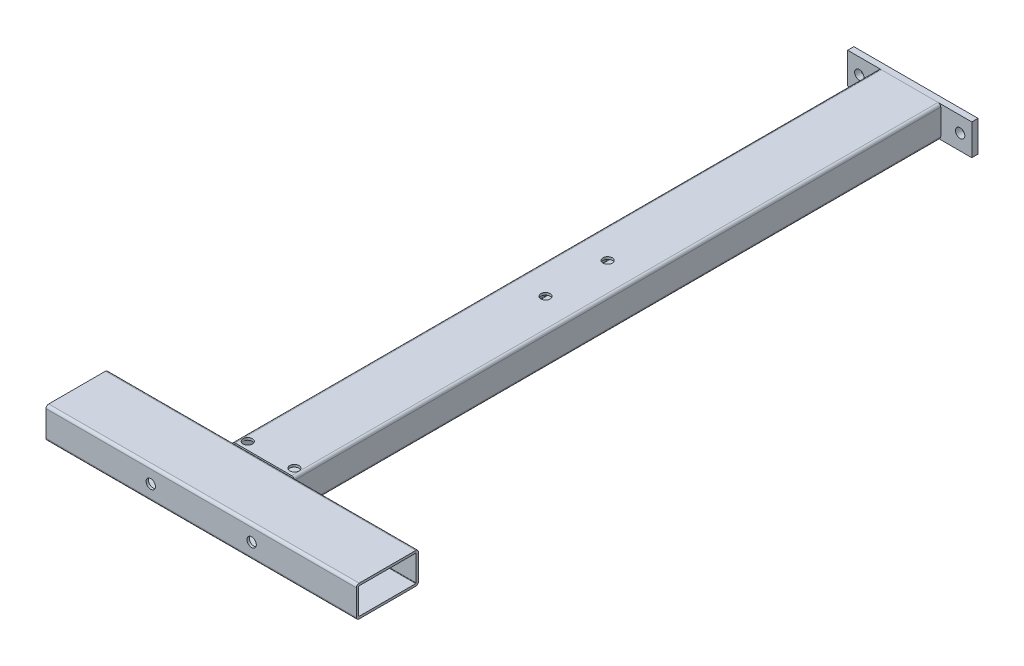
SolidWorks part; units mm, degrees
ref_plane "Plan de face" through (0, 0, 0) normal (0, 0, 1) x (1, 0, 0)
ref_plane "Plan de dessus" through (0, 0, 0) normal (0, 1, 0) x (1, 0, 0)
ref_plane "Plan de droite" through (0, 0, 0) normal (1, 0, 0) x (0, 0, -1)
sketch3d "Esquisse3D1"
  line L0 (0, 0, 0) -> (0, 0, -873)
  line L2 (-200, 0, 0) -> (200, 0, 0)
  point P5 (0, 0, 0)
  dimension "D1" = 400
  dimension "D2" = 873
other "Elément mécano-soudé1"
ref_plane "Plan1" through (-200, 0, 0) normal (1, 0, 0) x (0, 0, -1)
sketch "Sketch1" plane through (-200, 0, 0) normal (1, 0, 0) x (0, 0, -1)
  line L0 (-36.5, -17) -> (36.5, -17)
  line L1 (-37, -16.5) -> (-37, 16.5)
  line L2 (36.5, 17) -> (-36.5, 17)
  line L3 (37, 16.5) -> (37, -16.5)
  line L4 (-36.5, -20) -> (36.5, -20)
  line L5 (-40, -16.5) -> (-40, 16.5)
  line L6 (36.5, 20) -> (-36.5, 20)
  line L7 (40, 16.5) -> (40, -16.5)
  arc A0 (40, 16.5) -> (36.5, 20) centre (36.5, 16.5) ccw
  arc A1 (36.5, -20) -> (40, -16.5) centre (36.5, -16.5) ccw
  arc A2 (-40, -16.5) -> (-36.5, -20) centre (-36.5, -16.5) ccw
  arc A3 (-36.5, 20) -> (-40, 16.5) centre (-36.5, 16.5) ccw
  arc A4 (-36.5, 17) -> (-37, 16.5) centre (-36.5, 16.5) ccw
  arc A5 (37, 16.5) -> (36.5, 17) centre (36.5, 16.5) ccw
  arc A6 (36.5, -17) -> (37, -16.5) centre (36.5, -16.5) ccw
  arc A7 (-37, -16.5) -> (-36.5, -17) centre (-36.5, -16.5) ccw
  point P0 (0, 20)
  point P1 (40, 0)
  point P2 (0, -20)
  point P3 (-40, 0)
  point P4 (-40, 20)
  point P5 (40, 20)
  point P6 (40, -20)
  point P7 (-40, -20)
  point P8 (0, 0)
  point P33 (0, 0)
  dimension "D1" = 3.5
  dimension "D2" = 3
  dimension "V_leg" = 40
  dimension "H_leg" = 80
sketch3d "Esquisse3D2"
  line L0 (0, 0, -873) -> (0, 0, -881)
  dimension "D1" = 8
sketch "Esquisse3" plane through (0, 0, -873) normal (0, 0, -1) x (-1, 0, 0)
  line L1 (80, 20) -> (-80, 20)
  line L2 (80, 20) -> (80, -20)
  line L3 (80, -20) -> (-80, -20)
  line L4 (-80, 20) -> (-80, -20)
  point P4 (0, -20)
  point P6 (-80, 0)
  dimension "D1" = 160
  dimension "D2" = 40
extrude "Boss.-Extru.1" add sketch "Esquisse3" along normal blind 8 separate body
sketch "Esquisse4" plane through (0, 20, 0) normal (0, 1, 0) x (1, 0, 0)
  line L0 (40, 873) -> (40, 40) construction
  line L1 (36.5, 40) -> (-36.5, 40) construction
  circle A0 centre (30, 50) radius 6
  circle A1 centre (-30, 50) radius 6
  dimension "D3" = 12
  dimension "D4" = 12
  dimension "D1" = 10
  dimension "D2" = 60
  dimension "D5" = 10
extrude "Enlèv. mat.-Extru.1" cut sketch "Esquisse4" against normal up to next (3 mm away)
sketch "Esquisse5" plane through (0, 20, 0) normal (0, 1, 0) x (1, 0, 0)
  line L0 (0, 0) -> (0, 873) construction
  line L1 (-80, 881) -> (80, 881) construction
  circle A0 centre (0, 483.77) radius 6
  circle A1 centre (0, 403.77) radius 6
  dimension "D1" = 12
  dimension "D2" = 12
  dimension "D3" = 80
  dimension "D4" = 397.23
extrude "Enlèv. mat.-Extru.2" cut sketch "Esquisse5" against normal through all
sketch "Esquisse6" plane through (0, 0, 40) normal (0, 0, 1) x (1, 0, 0)
  line L0 (-200, 0) -> (200, 0) construction
  circle A0 centre (-65, 0) radius 6
  circle A1 centre (65, 0) radius 6
  dimension "D3" = 12
  dimension "D4" = 12
  dimension "D1" = 65
  dimension "D2" = 65
extrude "Enlèv. mat.-Extru.3" cut sketch "Esquisse6" against normal through all
sketch "Esquisse7" plane through (0, 20, 0) normal (0, 1, 0) x (-1, 0, 0)
  line L0 (0, -483.77) -> (0, -881)
  line L1 (80, -881) -> (-80, -881) construction
  dimension "D1" = 397.23
